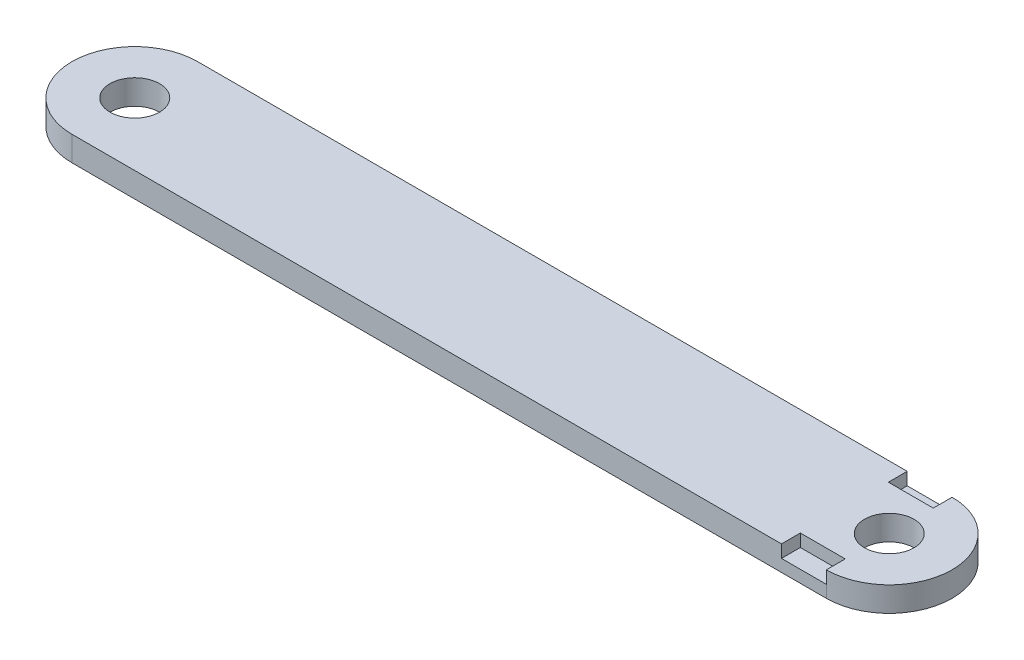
SolidWorks part; units mm, degrees
ref_plane "Front Plane" through (0, 0, 0) normal (0, 0, 1) x (1, 0, 0)
ref_plane "Top Plane" through (0, 0, 0) normal (0, 1, 0) x (1, 0, 0)
ref_plane "Right Plane" through (0, 0, 0) normal (1, 0, 0) x (0, 0, -1)
sketch "Sketch1" plane through (0, 0, 0) normal (0, 1, 0) x (1, 0, 0)
  line L0 (-73.5542, 11.3771) -> (78.8458, 11.3771)
  line L1 (-73.5542, -14.0229) -> (78.8458, -14.0229)
  arc A0 (-73.5542, -14.0229) -> (-73.5542, 11.3771) centre (-73.5542, -1.3229) cw
  arc A1 (78.8458, 11.3771) -> (78.8458, -14.0229) centre (78.8458, -1.3229) cw
  dimension "D2" = 12.7
  dimension "D1" = 152.4
extrude "Boss-Extrude1" add sketch "Sketch1" along normal blind 5
ref_point "Point3"
ref_point "Point4"
sketch "Sketch2" plane through (0, 0, 0) normal (0, 1, 0) x (1, 0, 0)
  circle A0 centre (-73.5542, -1.3229) radius 5
  circle A1 centre (78.8458, -1.3229) radius 5
  dimension "D1" = 10
  dimension "D2" = 10
extrude "Cut-Extrude1" cut sketch "Sketch2" along normal blind 5
sketch "Sketch3" plane through (0, 5, 0) normal (0, 1, 0) x (1, 0, 0)
  line L0 (78.8458, 11.3771) -> (-73.5542, 11.3771) construction
  line L1 (78.8458, 11.3771) -> (69.7762, 11.3771)
  line L2 (78.8458, 11.3771) -> (78.8458, 7.5671)
  line L3 (78.8458, 7.5671) -> (69.7762, 7.5671)
  line L4 (69.7762, 11.3771) -> (69.7762, 7.5671)
  line L5 (78.8458, -1.3229) -> (48.0476, -1.3229) construction
  line L6 (69.7762, -14.0229) -> (69.7762, -10.2129)
  line L7 (78.8458, -10.2129) -> (69.7762, -10.2129)
  line L8 (78.8458, -14.0229) -> (78.8458, -10.2129)
  line L9 (78.8458, -14.0229) -> (69.7762, -14.0229)
  arc A0 (78.8458, -14.0229) -> (78.8458, 11.3771) centre (78.8458, -1.3229) ccw construction
  arc A1 (78.8458, 11.3771) -> (69.7762, 7.5671) centre (78.8458, -1.3229) ccw construction
  dimension "D1" = 3.81
extrude "Cut-Extrude2" cut sketch "Sketch3" against normal blind 2.54
